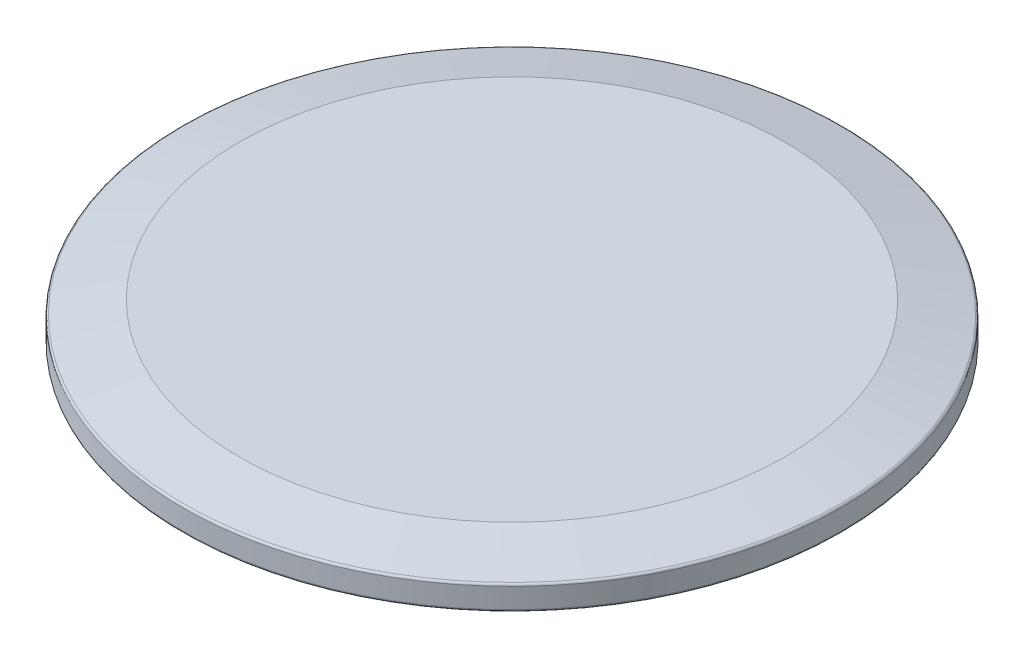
SolidWorks part; units mm, degrees
ref_plane "前视基准面" through (0, 0, 0) normal (0, 0, 1) x (1, 0, 0)
ref_plane "上视基准面" through (0, 0, 0) normal (0, 1, 0) x (1, 0, 0)
ref_plane "右视基准面" through (0, 0, 0) normal (1, 0, 0) x (0, 0, -1)
other "Configuration Table"
sketch "草图1" plane through (0, 0, 0) normal (0, 0, 1) x (1, 0, 0)
  line L0 (0, 0) -> (-31.75, 0)
  line L1 (-31.75, 0) -> (-35.25, 0)
  line L2 (-35.25, 0) -> (-43.5, 0)
  line L3 (-43.5, 0) -> (-43.5, 3.2)
  line L4 (-43.5, 3.2) -> (-36, 5)
  line L5 (-36, 5) -> (0, 5)
  line L6 (0, 5) -> (0, 0)
  line L7 (-35.25, 0) -> (-35.25, 2.5)
  line L8 (-35.25, 2.5) -> (-31.75, 2.5)
  line L9 (-31.75, 2.5) -> (-31.75, 0)
  point P8 (0, 0)
  point P11 (-12.1165, 5)
  dimension "D1" = 31.75
  dimension "D2" = 3.5
  dimension "D3" = 8.25
  dimension "D4" = 3.2
  dimension "D5" = 5
  dimension "D6" = 2.5
  dimension "D7" = 36
revolve "旋转1" add sketch "草图1" angle 360 about L6
fillet "圆角1" radius 0.3 1 edges at (-43.5, 3.2, 0)
fillet "圆角2" radius 0.3 1 edges at (-43.5, 0, 0)
fillet "圆角3" radius 0.3 1 edges at (-35.25, 0, 0)
